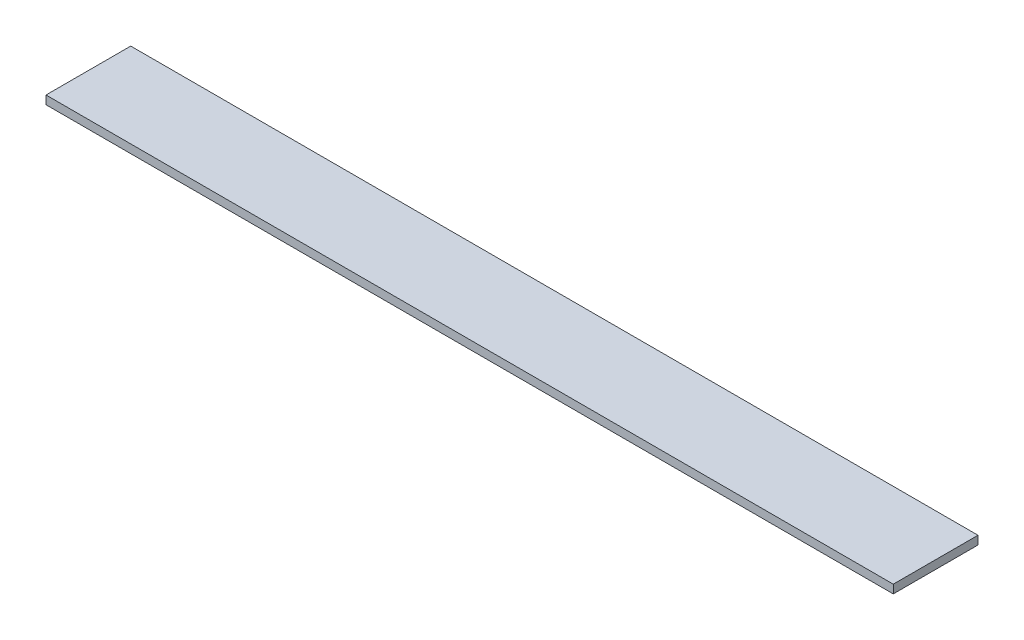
SolidWorks part; units mm, degrees
ref_plane "Front Plane" through (0, 0, 0) normal (0, 0, 1) x (1, 0, 0)
ref_plane "Top Plane" through (0, 0, 0) normal (0, 1, 0) x (1, 0, 0)
ref_plane "Right Plane" through (0, 0, 0) normal (1, 0, 0) x (0, 0, -1)
sketch "Sketch1" plane through (0, 0, 0) normal (0, 0, 1) x (1, 0, 0)
  line L1 (-500, -5) -> (500, -5)
  line L2 (-500, -5) -> (-500, 5)
  line L3 (-500, 5) -> (500, 5)
  line L4 (500, -5) -> (500, 5)
  line L5 (-500, -5) -> (500, 5) construction
  line L6 (-500, 5) -> (500, -5) construction
  point P0 (0, 0)
  dimension "D1" = 1000
  dimension "D2" = 10
extrude "Boss-Extrude1" add sketch "Sketch1" along normal mid plane 100
